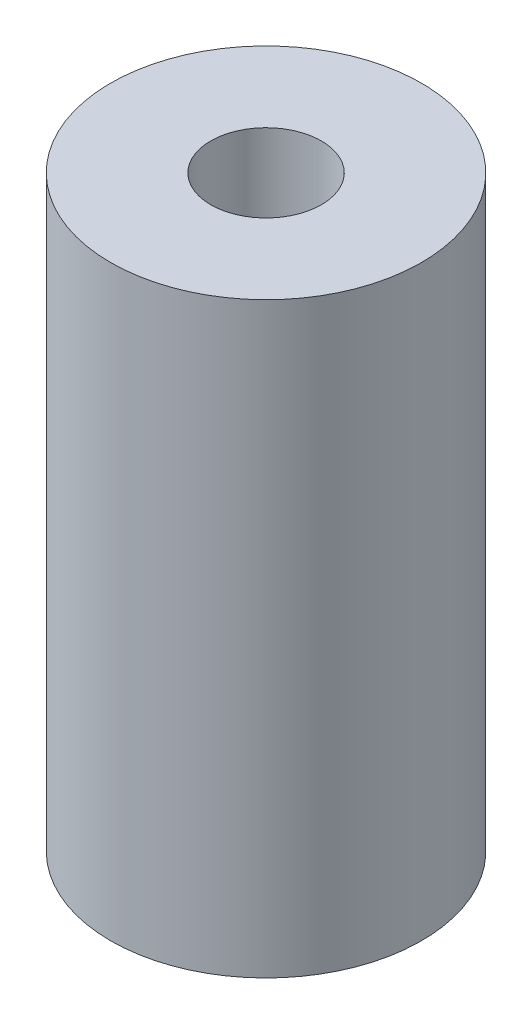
SolidWorks part; units mm, degrees
ref_plane "Front Plane" through (0, 0, 0) normal (0, 0, 1) x (1, 0, 0)
ref_plane "Top Plane" through (0, 0, 0) normal (0, 1, 0) x (1, 0, 0)
ref_plane "Right Plane" through (0, 0, 0) normal (1, 0, 0) x (0, 0, -1)
sketch "Sketch1" plane through (0, 0, 0) normal (0, 1, 0) x (1, 0, 0)
  circle A0 centre (0, 0) radius 3.175
  circle A1 centre (0, 0) radius 1.1303
  dimension "D1" = 6.35
  dimension "D2" = 2.2606
extrude "body" add sketch "Sketch1" along normal blind 12
